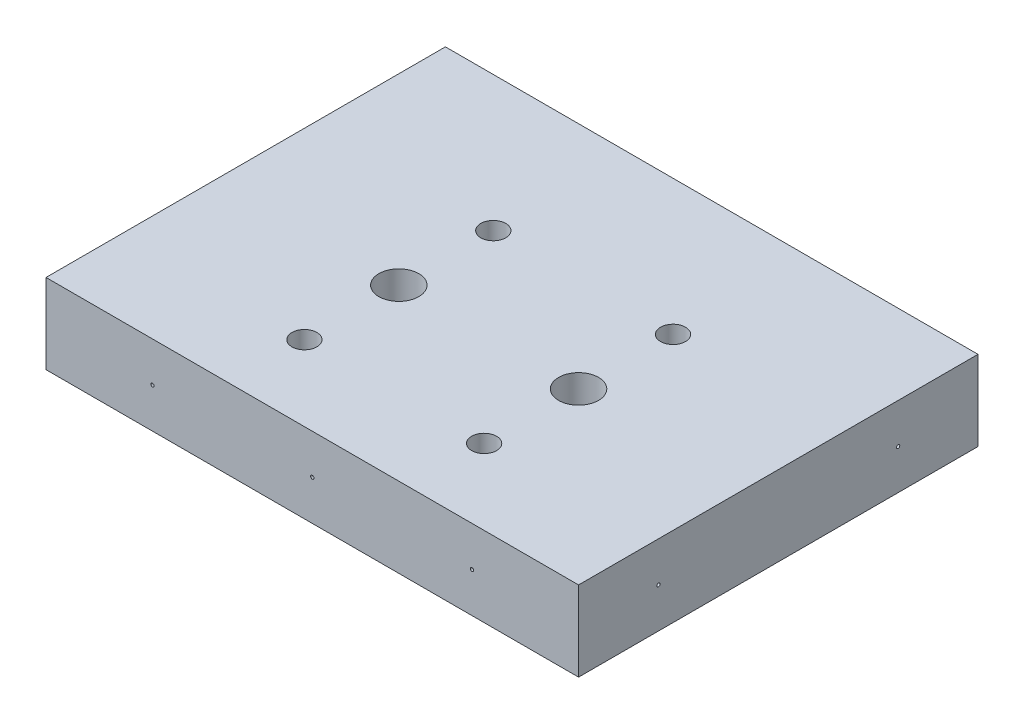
SolidWorks part; units mm, degrees
ref_plane "Front Plane" through (0, 0, 0) normal (0, 0, 1) x (1, 0, 0)
ref_plane "Top Plane" through (0, 0, 0) normal (0, 1, 0) x (1, 0, 0)
ref_plane "Right Plane" through (0, 0, 0) normal (1, 0, 0) x (0, 0, -1)
sketch "Sketch1" plane through (0, 0, 0) normal (0, 1, 0) x (1, 0, 0)
  line L1 (0, 0) -> (254, 0)
  line L2 (0, 0) -> (0, 190.5)
  line L3 (0, 190.5) -> (254, 190.5)
  line L4 (254, 0) -> (254, 190.5)
  dimension "D1" = 254
  dimension "D2" = 190.5
extrude "Boss-Extrude1" add sketch "Sketch1" along normal blind 38.1
hole_wizard "1/16 (0.0625) Diameter Hole7" positions "Sketch2" profile "Sketch4" hole size "1/16" standard "ANSI Inch"
sketch "Sketch2" plane through (0, 0, 0) normal (0, 0, 1) x (1, 0, 0)
  point P0 (50.8, 19.05)
  point P2 (203.2, 19.05)
  point P9 (127, 19.05)
  dimension "D1" = 50.8
  dimension "D2" = 127
  dimension "D3" = 19.05
  dimension "D4" = 50.8
sketch "Sketch4" plane through (50.8, 19.05, 0) normal (1, 0, 0) x (0, -1, 0)
  line L0 (0, 0) -> (0, 51.2769)
  line L1 (0, 51.2769) -> (0.7937, 50.8)
  line L2 (0.7937, 50.8) -> (0.7937, 0)
  line L5 (0.7937, 0) -> (0, 0)
  line L10 (0, 51.2769) -> (-0.7938, 50.8) construction
  line L11 (0, -6.35) -> (0, 107.95) construction
  dimension "Hole Dia." = 1.5875
  dimension "Hole Depth" = 50.8
  dimension "Drill Angle" = 118
hole_wizard "3/4 (0.75) Diameter Hole1" positions "Sketch12" profile "Sketch14" hole size "3/4" standard "ANSI Inch"
sketch "Sketch12" plane through (0, 0, 0) normal (0, -1, 0) x (-1, 0, 0)
  line L0 (0, 0) -> (-254, 0) construction
  point P0 (-173.0375, 80.9625)
  point P13 (-87.3125, 80.9625)
  dimension "D1" = 80.9625
  dimension "D2" = 80.9625
  dimension "D3" = 166.6875
  dimension "D4" = 87.3125
sketch "Sketch14" plane through (173.0375, 0, -80.9625) normal (1, 0, 0) x (0, 0, -1)
  line L0 (0, 0) -> (0, 38.1)
  line L1 (0, 38.1) -> (9.525, 38.1)
  line L2 (9.525, 38.1) -> (9.525, 0)
  line L5 (9.525, 0) -> (0, 0)
  line L11 (0, -6.35) -> (0, 107.95) construction
  dimension "Thru Hole Dia." = 19.05
  dimension "Thru Hole Depth" = 38.1
hole_wizard "1/16 (0.0625) Diameter Hole8" positions "Sketch15" profile "Sketch16" hole size "1/16" standard "ANSI Inch"
sketch "Sketch15" plane through (254, 0, 0) normal (1, 0, 0) x (0, 0, -1)
  point P0 (152.4, 19.05)
  point P2 (38.1, 19.05)
  dimension "D1" = 38.1
  dimension "D2" = 38.1
  dimension "D3" = 19.05
sketch "Sketch16" plane through (254, 19.05, -152.4) normal (0, 1, 0) x (0, 0, -1)
  line L0 (0, 0) -> (0, 38.5769)
  line L1 (0, 38.5769) -> (0.7937, 38.1)
  line L2 (0.7937, 38.1) -> (0.7937, 0)
  line L5 (0.7937, 0) -> (0, 0)
  line L10 (0, 38.5769) -> (-0.7938, 38.1) construction
  line L11 (0, -6.35) -> (0, 107.95) construction
  dimension "Hole Dia." = 1.5875
  dimension "Hole Depth" = 38.1
  dimension "Drill Angle" = 118
hole_wizard "1/16 (0.0625) Diameter Hole9" positions "Sketch17" profile "Sketch18" hole size "1/16" standard "ANSI Inch"
sketch "Sketch17" plane through (0, 0, 0) normal (-1, 0, 0) x (0, 0, 1)
  point P0 (-152.4, 19.05)
  point P2 (-38.1, 19.05)
  dimension "D1" = 38.1
  dimension "D2" = 38.1
  dimension "D3" = 19.05
sketch "Sketch18" plane through (0, 19.05, -152.4) normal (0, 1, 0) x (0, 0, 1)
  line L0 (0, 0) -> (0, 38.5769)
  line L1 (0, 38.5769) -> (0.7937, 38.1)
  line L2 (0.7937, 38.1) -> (0.7937, 0)
  line L5 (0.7937, 0) -> (0, 0)
  line L10 (0, 38.5769) -> (-0.7938, 38.1) construction
  line L11 (0, -6.35) -> (0, 107.95) construction
  dimension "Hole Dia." = 1.5875
  dimension "Hole Depth" = 38.1
  dimension "Drill Angle" = 118
hole_wizard "15/32 (0.46875) Diameter Hole1" positions "Sketch21" profile "Sketch22" hole size "15/32" standard "ANSI Inch"
sketch "Sketch21" plane through (0, 38.1, 0) normal (0, 1, 0) x (1, 0, 0)
  point P0 (87.3125, 35.9172)
  point P2 (87.3125, 126.0078)
  point P19 (173.0375, 126.0078)
  point P21 (173.0375, 35.9172)
  point P24 (0, 0)
  point P25 (0, 0)
  point P26 (0, 0)
  point P27 (0, 0)
  point P28 (0, 0)
  dimension "D1" = 80.9625
  dimension "D4" = 35.9172
  dimension "D5" = 90.0906
  dimension "D6" = 166.6875
sketch "Sketch22" plane through (87.3125, 38.1, -35.9172) normal (1, 0, 0) x (0, 0, 1)
  line L0 (0, 0) -> (0, 38.1)
  line L1 (0, 38.1) -> (5.9531, 38.1)
  line L2 (5.9531, 38.1) -> (5.9531, 0)
  line L5 (5.9531, 0) -> (0, 0)
  line L11 (0, -6.35) -> (0, 107.95) construction
  dimension "Thru Hole Dia." = 11.9062
  dimension "Thru Hole Depth" = 38.1
